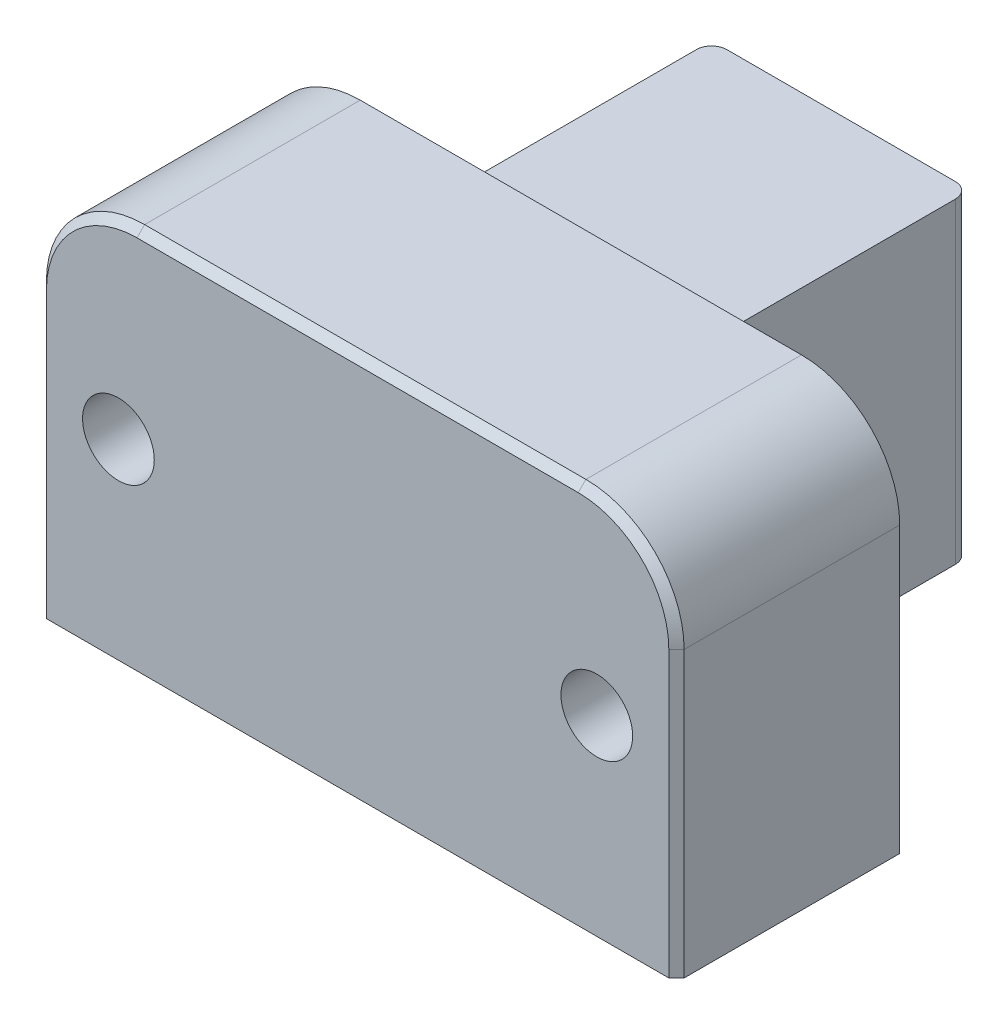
SolidWorks part; units mm, degrees
ref_plane "Front Plane" through (0, 0, 0) normal (0, 0, 1) x (1, 0, 0)
ref_plane "Top Plane" through (0, 0, 0) normal (0, 1, 0) x (1, 0, 0)
ref_plane "Right Plane" through (0, 0, 0) normal (1, 0, 0) x (0, 0, -1)
sketch "Sketch1" plane through (0, 0, 0) normal (0, 1, 0) x (1, 0, 0)
  line L0 (0, 42.6503) -> (0, -22.9644) construction
  line L1 (0, -55) -> (0, 55) construction
  line L2 (-55, 0) -> (55, 0) construction
  line L3 (-31.7436, 0) -> (-12.8905, 0)
  line L4 (-31.7436, 0) -> (-31.7436, -22.225)
  line L5 (-31.7436, -22.225) -> (31.7437, -22.225)
  line L6 (31.7437, 0) -> (31.7437, -22.225)
  line L7 (12.8905, 0) -> (31.7437, 0)
  line L8 (-12.8905, 25.908) -> (-12.8905, 0)
  line L9 (-12.8905, 25.908) -> (12.8905, 25.908)
  line L10 (12.8905, 25.908) -> (12.8905, 0)
  dimension "D1" = 63.4873
  dimension "D2" = 31.7436
  dimension "D3" = 22.225
  dimension "D4" = 25.781
  dimension "D5" = 12.8905
  dimension "D6" = 25.908
extrude "Extrude1" add sketch "Sketch1" along normal blind 38.1
sketch "Sketch3" plane through (0, 0, 0) normal (1, 0, 0) x (0, 0, -1)
  line L0 (0, 20.955) -> (0, -20.955) construction
  line L1 (50.8, -5.329) -> (0, -5.329)
  line L2 (50.8, -5.329) -> (50.8, 3.302)
  line L3 (50.8, 3.302) -> (0, 3.302)
  line L4 (0, -5.329) -> (0, 3.302)
  line L5 (50.8, 34.798) -> (0, 34.798)
  line L6 (50.8, 34.798) -> (50.8, 42.418)
  line L7 (50.8, 42.418) -> (0, 42.418)
  line L8 (0, 34.798) -> (0, 42.418)
  line L9 (0, 38.1) -> (0, 0) construction
  line L10 (0, 38.1) -> (25.908, 38.1) construction
  line L11 (26.4731, 0) -> (-26.4731, 0) construction
  dimension "D1" = 3.302
  dimension "D2" = 3.302
  dimension "D3" = 7.62
  dimension "D4" = 50.8
  dimension "D5" = 50.8
  dimension "D6" = 5.329
extrude "Cut-Extrude2" cut sketch "Sketch3" against normal mid plane 50.8
fillet "Fillet2" radius 1.524 2 edges at (12.8905, 19.05, -25.908) (-12.8905, 19.05, -25.908)
fillet "Fillet3" radius 0.7874 2 edges at (-12.8905, 19.05, 0) (12.8905, 19.05, 0)
fillet "Fillet4" radius 9.779 2 edges at (31.7437, 38.1, 11.1125) (-31.7436, 38.1, 11.1125)
ref_plane "Plane1" through (0, 19.05, 0) normal (0, 1, 0) x (-1, 0, 0)
sketch "Sketch4" plane through (0, 19.05, 0) normal (0, 1, 0) x (-1, 0, 0)
  line L0 (23.8125, 26.8652) -> (23.8125, -2.0432) construction
  line L1 (23.8125, 22.225) -> (20.2438, 22.225)
  line L2 (20.2438, 22.225) -> (20.2438, 6.7564)
  line L3 (20.2438, 6.7564) -> (18.6563, 6.7564)
  line L4 (18.6563, 6.7564) -> (18.6563, 0)
  line L5 (18.6563, 0) -> (23.8125, 0)
  line L6 (23.8125, 0) -> (23.8125, 22.225)
  line L7 (-31.7437, 0) -> (31.7436, 0) construction
  line L8 (31.7436, 22.225) -> (-31.7437, 22.225) construction
  line L10 (0, 20.955) -> (0, -20.955) construction
  dimension "D1" = 10.3124
  dimension "D2" = 6.7564
  dimension "D3" = 7.1374
  dimension "D4" = 23.8125
revolve "Cut-Revolve1" cut sketch "Sketch4" angle 360 about L0
mirror "Mirror1" about plane through (0, 0, 0) normal (1, 0, 0) of "Cut-Revolve1"
chamfer "Chamfer1" distance 0.762 angle 45 5 edges at (-31.7436, 14.1605, 22.225) (-28.8794, 35.2358, 22.225) (0, 38.1, 22.225) (28.8794, 35.2358, 22.225) (31.7437, 14.1605, 22.225)
